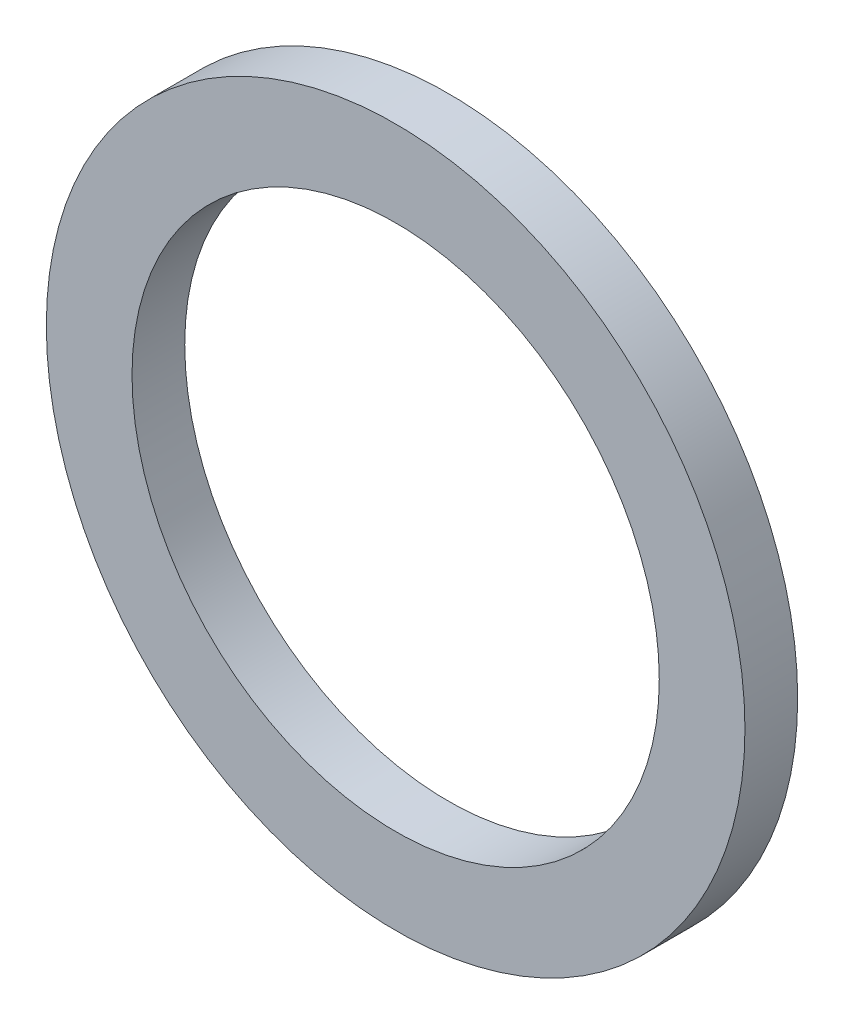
SolidWorks part; units mm, degrees
ref_plane "Front" through (0, 0, 0) normal (0, 0, 1) x (1, 0, 0)
ref_plane "Top" through (0, 0, 0) normal (0, 1, 0) x (1, 0, 0)
ref_plane "Right" through (0, 0, 0) normal (1, 0, 0) x (0, 0, -1)
sketch "Sketch1" plane through (0, 0, 0) normal (0, 0, 1) x (1, 0, 0)
  circle A0 centre (0, 0) radius 2
  circle A1 centre (0, 0) radius 2.65
  dimension "D1" = 4
  dimension "D2" = 5.3
extrude "Extrude1" add sketch "Sketch1" along normal blind 0.4
